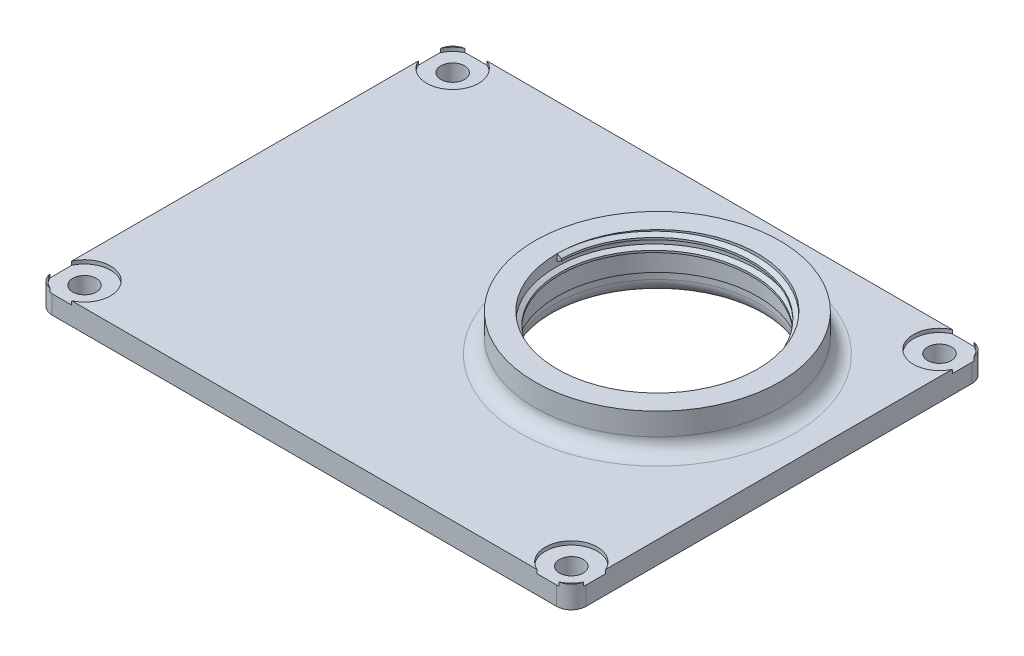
SolidWorks part; units mm, degrees
ref_plane "前视基准面" through (0, 0, 0) normal (0, 0, 1) x (1, 0, 0)
ref_plane "上视基准面" through (0, 0, 0) normal (0, 1, 0) x (1, 0, 0)
ref_plane "右视基准面" through (0, 0, 0) normal (1, 0, 0) x (0, 0, -1)
sketch "草图1" plane through (0, 0, 0) normal (0, 1, 0) x (1, 0, 0)
  line L0 (-36, 28) -> (-18.6848, 10.6848) construction
  line L1 (-36, -28) -> (36, -28)
  line L2 (-36, -28) -> (-36, 28)
  line L3 (-36, 28) -> (36, 28)
  line L4 (36, -28) -> (36, 28)
  line L5 (-36, -28) -> (36, 28) construction
  line L6 (-36, 28) -> (36, -28) construction
  line L7 (-36, 28) -> (-18.6848, 28)
  line L8 (-36, 28) -> (-36, 10.6848)
  line L9 (-36, 10.6848) -> (-18.6848, 10.6848)
  line L10 (-18.6848, 28) -> (-18.6848, 10.6848)
  line L11 (-36, -28) -> (-18.6848, -28)
  line L12 (-36, -28) -> (-36, -10.6848)
  line L13 (-36, -10.6848) -> (-18.6848, -10.6848)
  line L14 (-18.6848, -28) -> (-18.6848, -10.6848)
  line L15 (36, 28) -> (20.8292, 28)
  line L16 (36, 28) -> (36, 12.8292)
  line L17 (36, 12.8292) -> (20.8292, 12.8292)
  line L18 (20.8292, 28) -> (20.8292, 12.8292)
  line L19 (36, -28) -> (20.8292, -28)
  line L20 (36, -28) -> (36, -12.8292)
  line L21 (36, -12.8292) -> (20.8292, -12.8292)
  line L22 (20.8292, -28) -> (20.8292, -12.8292)
  line L23 (20.8292, 12.8292) -> (36, 28) construction
  line L24 (-36, -28) -> (-18.6848, -10.6848) construction
  line L25 (36, -28) -> (20.8292, -12.8292) construction
  circle A0 centre (-32.818, 24.818) radius 1.6
  circle A1 centre (32.818, 24.818) radius 1.6
  circle A2 centre (-32.818, -24.818) radius 1.6
  circle A3 centre (32.818, -24.818) radius 1.6
  point P0 (0, 0)
  dimension "D3" = 4.5
  dimension "D1" = 56
  dimension "D2" = 72
  dimension "D4" = 4.5
  dimension "D5" = 4.5
  dimension "D6" = 4.5
extrude "凸台-拉伸1" add sketch "草图1" along normal blind 3 contours L1 L22 L21 L4 L17 L18 L3 L10 L9 L2 L13 L14 | L1 L14 L13 L2 A2 | L22 L1 L4 L21 A3 | L3 L18 L17 L4 A1 | L10 L3 L2 L9 A0
sketch "草图2" plane through (0, 3, 0) normal (0, 1, 0) x (1, 0, 0)
  line L0 (14.35, 5.25) -> (0.6, 5.25) construction
  line L1 (14.35, 5.25) -> (14.35, 19) construction
  line L4 (-36, -28) -> (36, -28)
  line L5 (36, -28) -> (36, 28)
  line L6 (36, 28) -> (-36, 28)
  line L7 (-36, 28) -> (-36, -28)
  line L8 (-36, -28) -> (36, -28)
  line L9 (36, -28) -> (36, 28)
  line L10 (36, 28) -> (-36, 28)
  line L11 (-36, 28) -> (-36, -28)
  circle A0 centre (14.35, 5.25) radius 13.75
  dimension "D2" = 35.4
  dimension "D4" = 27.5
  dimension "D3" = 47
  dimension "D1" = 0
extrude "切除-拉伸1" cut sketch "草图2" against normal blind 3 contours A0
sketch "草图3" plane through (0, 3, 0) normal (0, 1, 0) x (1, 0, 0)
  circle A0 centre (14.35, 5.25) radius 13.5
  circle A1 centre (14.35, 5.25) radius 16.5
  dimension "D1" = 3
extrude "凸台-拉伸2" add sketch "草图3" along normal blind 5
fillet "圆角1" radius 2 6 edges at (14.35, 0, 8.5) (14.35, 3, 11.25) (-36, 1.5, -28) (36, 1.5, -28) (36, 1.5, 28) (-36, 1.5, 28)
thread "螺纹线1" pitch 1.0583 start angle 0, offset 0, length 0, pitch 1.5, diameter 27
ref_plane "基准面4" through (0.85, 8, -5.25) normal (0, 0, 1) x (-1, 0, 0)
sketch "螺纹线轮廓1" plane through (0.85, 8, -5.25) normal (0, 0, 1) x (-1, 0, 0)
  line L0 (0, 0) -> (0, 1.0583) construction
  line L11 (0, 0) -> (0, 0.926)
  line L12 (0, 0.926) -> (-0.5728, 0.5953)
  line L13 (-0.5728, 0.5953) -> (-0.5728, 0.3307)
  line L15 (-0.5728, 0.3307) -> (0, 0)
  line L17 (-0.5728, 0.463) -> (0, 0.463) construction
  point P2 (0, 0)
  dimension "Pitch" = 1.0583
  dimension "Profile_Angle" = 60
  dimension "Profile_Land" = 0.2646
  dimension "Profile_Height" = 0.5728
sketch "草图8" plane through (0, 8, 0) normal (0, 1, 0) x (1, 0, 0)
  circle A0 centre (14.1259, 3.4819) radius 12.9308
sketch "草图9" plane through (0, 3, 0) normal (0, 1, 0) x (1, 0, 0)
  line L4 (34, 28) -> (-34, 28)
  line L5 (-36, 26) -> (-36, -26)
  line L6 (-34, -28) -> (34, -28)
  line L7 (36, -26) -> (36, 26)
  line L8 (34, 28) -> (-34, 28)
  line L9 (-36, 26) -> (-36, -26)
  line L10 (-34, -28) -> (34, -28)
  line L11 (36, -26) -> (36, 26)
  circle A0 centre (-32.818, 24.818) radius 3.5
  circle A1 centre (32.818, 24.818) radius 3.5
  circle A2 centre (-32.818, -24.818) radius 3.5
  circle A3 centre (32.818, -24.818) radius 3.5
  arc A4 (-34, 28) -> (-36, 26) centre (-34, 26) ccw
  arc A5 (-36, -26) -> (-34, -28) centre (-34, -26) ccw
  arc A6 (34, -28) -> (36, -26) centre (34, -26) ccw
  arc A7 (36, 26) -> (34, 28) centre (34, 26) ccw
  arc A8 (-34, 28) -> (-36, 26) centre (-34, 26) ccw
  arc A9 (-36, -26) -> (-34, -28) centre (-34, -26) ccw
  arc A10 (34, -28) -> (36, -26) centre (34, -26) ccw
  arc A11 (36, 26) -> (34, 28) centre (34, 26) ccw
  dimension "D1" = 0
extrude "切除-拉伸2" cut sketch "草图9" against normal blind 0.5 contours A0 L8 M11 M12 M19 | A1 L11 M17 M10 M20 | A3 M15 M16 M14 M21 | A2 M14 M12 M13 M18
